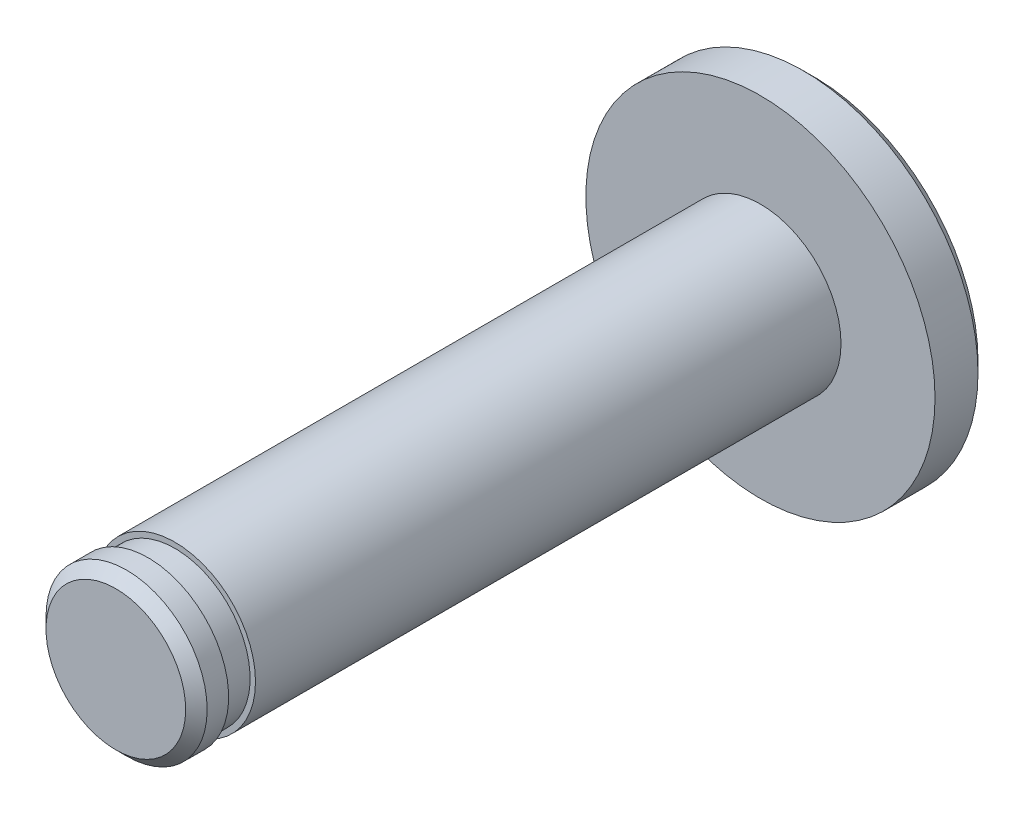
SolidWorks part; units mm, degrees
ref_plane "Face" through (0, 0, 0) normal (0, 0, 1) x (1, 0, 0)
ref_plane "Dessus" through (0, 0, 0) normal (0, 1, 0) x (1, 0, 0)
ref_plane "Droite" through (0, 0, 0) normal (1, 0, 0) x (0, 0, -1)
sketch "Esquisse1" plane through (0, 0, 0) normal (0, 0, 1) x (1, 0, 0)
  circle A0 centre (0, 0) radius 3.25
  dimension "D1" = 6.5
extrude "Extrusion1" add sketch "Esquisse1" along normal blind 1
sketch "Esquisse2" plane through (0, 0, 1) normal (0, 0, 1) x (1, 0, 0)
  circle A0 centre (0, 0) radius 1.5
  dimension "D1" = 3
extrude "Extrusion2" add sketch "Esquisse2" along normal blind 12
chamfer "Chanfrein1" distance 0.2 angle 45 2 edges at (3.25, 0, 0) (1.5, 0, 13)
sketch "Esquisse3" plane through (0, 0, 0) normal (0, 1, 0) x (1, 0, 0)
  line L0 (0, 0) -> (0, -9.5693) construction
  line L1 (1.7565, -11.9) -> (1.4, -11.9)
  line L2 (1.7565, -11.9) -> (1.7565, -12.4)
  line L3 (1.7565, -12.4) -> (1.4, -12.4)
  line L4 (1.4, -11.9) -> (1.4, -12.4)
  line L5 (-3.25, -1) -> (3.25, -1) construction
  dimension "D1" = 10.9
  dimension "D2" = 0.5
  dimension "D3" = 1.4
revolve "Enlèvement de matière-Révolution1" cut sketch "Esquisse3" angle 360 about L0
